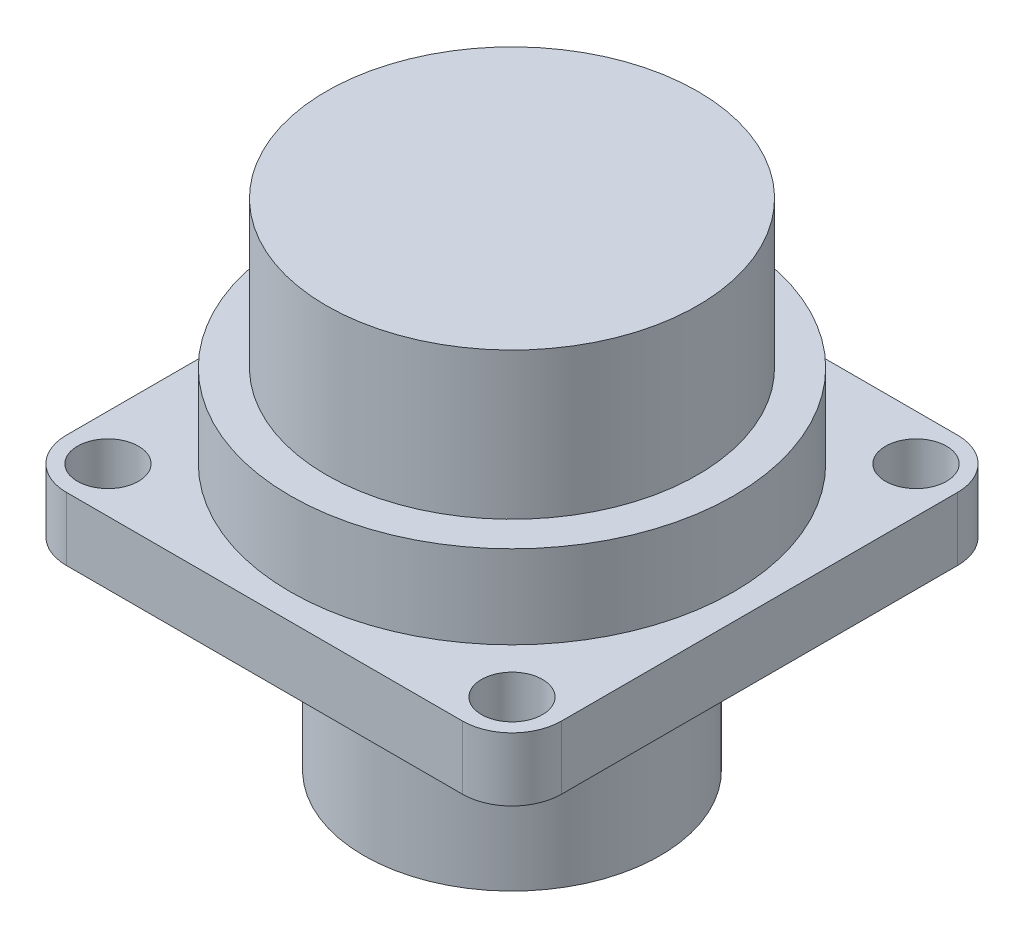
SolidWorks part; units mm, degrees
ref_plane "FRONT" through (0, 0, 0) normal (0, 0, 1) x (1, 0, 0)
ref_plane "TOP" through (0, 0, 0) normal (0, 1, 0) x (1, 0, 0)
ref_plane "RIGHT" through (0, 0, 0) normal (1, 0, 0) x (0, 0, -1)
sketch "Sketch2" plane through (0, 0, 0) normal (0, 1, 0) x (1, 0, 0)
  line L0 (0, 15.875) -> (0, 0) construction
  line L1 (-15.875, 0) -> (0, 0) construction
  line L2 (12.7, 15.875) -> (-12.7, 15.875)
  line L3 (-15.875, 12.7) -> (-15.875, -12.7)
  line L4 (-15.8524, 15.8524) -> (0, 0) construction
  line L5 (12.7, -15.875) -> (-12.7, -15.875)
  line L6 (15.875, 12.7) -> (15.875, -12.7)
  circle A0 centre (-12.954, 12.954) radius 1.9558
  arc A1 (-15.875, 12.7) -> (-12.7, 15.875) centre (-12.7, 12.7) cw
  arc A2 (-15.875, -12.7) -> (-12.7, -15.875) centre (-12.7, -12.7) ccw
  circle A3 centre (-12.954, -12.954) radius 1.9558
  circle A4 centre (12.954, -12.954) radius 1.9558
  arc A5 (15.875, -12.7) -> (12.7, -15.875) centre (12.7, -12.7) cw
  arc A6 (15.875, 12.7) -> (12.7, 15.875) centre (12.7, 12.7) ccw
  circle A7 centre (12.954, 12.954) radius 1.9558
  point P26 (0, -15.875)
  dimension "D3" = 3.9116
  dimension "D5" = 3.175
  dimension "D1" = 15.875
  dimension "D2" = 15.875
  dimension "D4" = 12.954
  dimension "D6" = 45
extrude "Base-Extrude" add sketch "Sketch2" along normal blind 4.064
sketch "Sketch3" plane through (0, 4.064, 0) normal (0, 1, 0) x (-1, 0, 0)
  circle A0 centre (0, 0) radius 14.224
  dimension "D1" = 28.448
extrude "Boss-Extrude1" add sketch "Sketch3" along normal blind 5.334
sketch "Sketch4" plane through (0, 9.398, 0) normal (0, 1, 0) x (-1, 0, 0)
  circle A0 centre (0, 0) radius 11.9062
  dimension "D1" = 23.8125
extrude "Boss-Extrude2" add sketch "Sketch4" along normal blind 9.398
sketch "Sketch5" plane through (0, 0, 0) normal (0, -1, 0) x (1, 0, 0)
  circle A0 centre (0, 0) radius 9.4996
  dimension "D1" = 18.9992
extrude "Boss-Extrude3" add sketch "Sketch5" along normal blind 12.954
